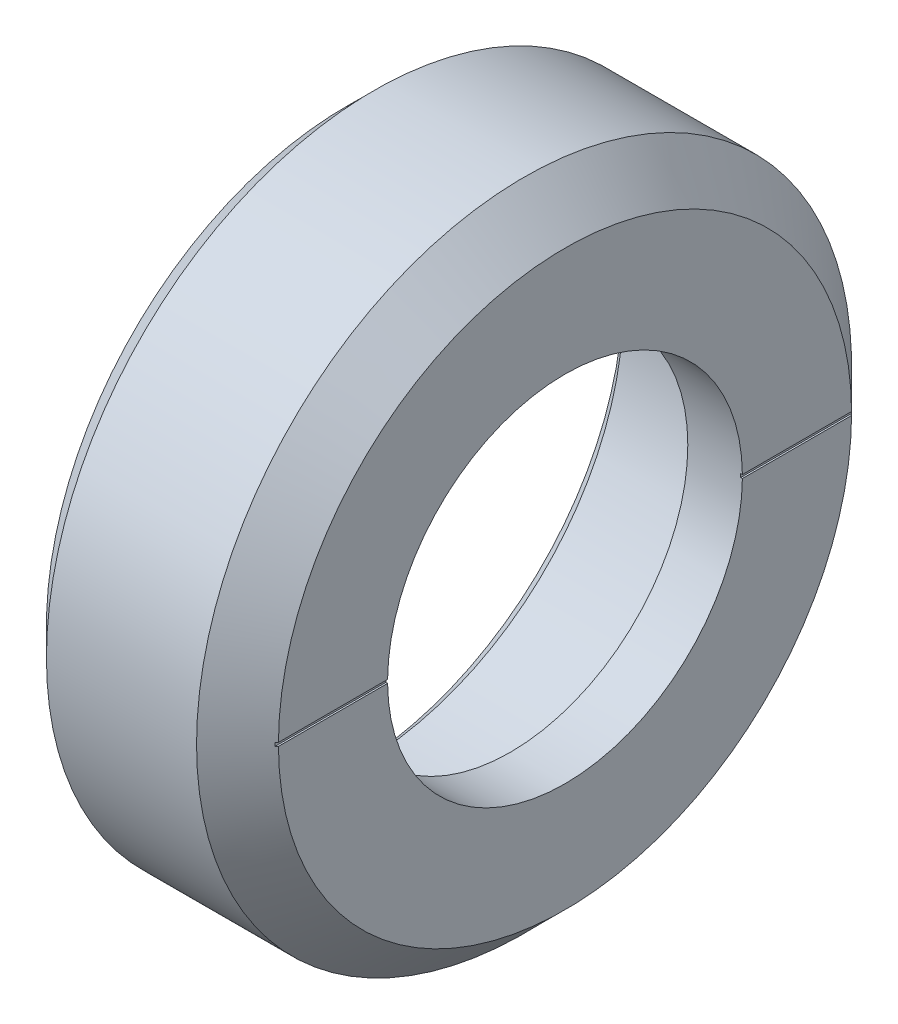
SolidWorks part; units mm, degrees
ref_plane "Plan1" through (0, 0, 0) normal (0, 0, 1) x (1, 0, 0)
ref_plane "Plan2" through (0, 0, 0) normal (0, 1, 0) x (1, 0, 0)
ref_plane "Plan3" through (0, 0, 0) normal (1, 0, 0) x (0, 0, -1)
sketch "Esquisse1" plane through (0, 0, 0) normal (0, 0, 1) x (1, 0, 0)
  line L0 (0, 0) -> (20, 0) construction
  line L1 (0, 19.25) -> (0, 24)
  line L2 (0, 24) -> (16, 24)
  line L3 (16, 24) -> (16, 13)
  line L4 (16, 13) -> (12, 13)
  line L5 (12, 13) -> (12, 20.25)
  line L6 (12, 20.25) -> (11, 20.25)
  line L7 (11, 20.25) -> (11, 19.25)
  line L8 (11, 19.25) -> (0, 19.25)
  dimension "D1" = 24
  dimension "D2" = 13
  dimension "D3" = 19.25
  dimension "D4" = 1
  dimension "D5" = 16
  dimension "D6" = 1
  dimension "D7" = 12
revolve "Base-Révolution" add sketch "Esquisse1"
chamfer "Chanfrein3" distance 1 angle 45 1 edges at (0, 0, 19.25)
chamfer "Chanfrein1" distance 3 angle 45 1 edges at (16, 0, 24)
chamfer "Chanfrein2" distance 2 angle 45 1 edges at (0, 0, 24)
sketch "Esquisse2" plane through (0, 0, 0) normal (0, 0, 1) x (1, 0, 0)
  line L0 (0, 0) -> (20, 0) construction
  line L1 (16, -21) -> (16, 21) construction
  line L2 (18, 0.125) -> (15.875, 0.125)
  line L3 (18, 0.125) -> (18, -0.125)
  line L4 (18, -0.125) -> (15.875, -0.125)
  line L5 (15.875, 0.125) -> (15.875, -0.125)
  line L6 (16, -21) -> (16, 21) construction
  dimension "D1" = 0.25
  dimension "D2" = 2
  dimension "D3" = 0.25
extrude "Enlèv. mat.-Extru.1" cut sketch "Esquisse2" along normal mid plane 83
sketch "Esq_WRNL_Compact001" plane through (0, 0, 0) normal (0, 0, 1) x (1, 0, 0)
  line L0 (-1, -25) -> (-1, 25)
  line L1 (17, -25) -> (17, 25)
  line L2 (-1, -25) -> (17, -25)
  line L3 (-1, 25) -> (17, 25)
